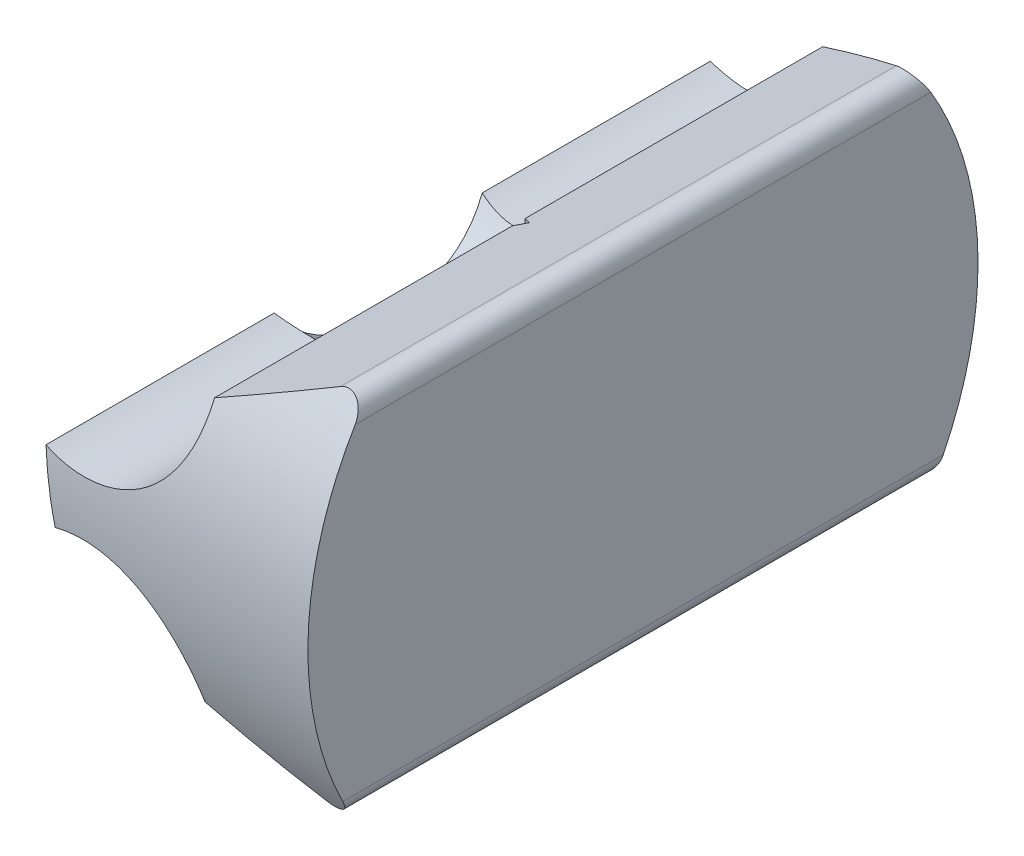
SolidWorks part; units mm, degrees
ref_plane "Front Plane" through (0, 0, 0) normal (0, 0, 1) x (1, 0, 0)
ref_plane "Top Plane" through (0, 0, 0) normal (0, 1, 0) x (1, 0, 0)
ref_plane "Right Plane" through (0, 0, 0) normal (1, 0, 0) x (0, 0, -1)
sketch "Sketch1" plane through (0, 0, 0) normal (0, 0, 1) x (1, 0, 0)
  line L0 (0, 0.6379) -> (0, 8.1632)
  line L1 (-0.5782, 8.5315) -> (-2.921, 7.439)
  line L2 (-6.223, 5.1625) -> (-5.9543, 3.6385)
  line L3 (-2.921, 1.3621) -> (-0.5782, 0.2696)
  line L4 (-6.1168, 8.0381) -> (-6.1168, -3.6188) construction
  line L5 (-14.1613, 4.4005) -> (14.1613, 4.4005) construction
  arc A0 (-2.921, 7.439) -> (-6.223, 5.1625) centre (-5.3075, 7.3677) cw
  arc A1 (-5.9543, 3.6385) -> (-2.921, 1.3621) centre (-5.3085, 1.3399) cw
  arc A2 (0, 0.6379) -> (-0.5782, 0.2696) centre (-0.4064, 0.6379) cw
  arc A3 (0, 8.1632) -> (-0.5782, 8.5315) centre (-0.4064, 8.1632) ccw
  point P13 (-6.0886, 4.4005)
  point P14 (0, 4.4005)
  point P17 (0, 0)
  point P20 (0, 8.8011)
  dimension "D1" = 2.3876
  dimension "D10" = 0.4064
  dimension "D2" = 8.8011
  dimension "D3" = 10
  dimension "D4" = 50
  dimension "D5" = 2.921
  dimension "D6" = 2.921
  dimension "D7" = 1.524
  dimension "D8" = 6.223
  dimension "D9" = 25
extrude "Boss-Extrude1" add sketch "Sketch1" along normal blind 15.9004
sketch "Sketch2" plane through (0, 0, 0) normal (1, 0, 0) x (0, 0, -1)
  line L0 (-7.9502, 8.8452) -> (-7.9502, 0) construction
  line L1 (0, 0.6379) -> (0, 8.1632) construction
  line L2 (0.0044, 4.131) -> (-15.9048, 4.131) construction
  line L3 (-15.9004, 8.5315) -> (0, 8.5315) construction
  line L4 (-2.743, -1.7754) -> (-13.5465, -1.4081)
  line L5 (-12.2587, 10.7216) -> (-3.7002, 10.7595)
  line L6 (-3.7002, 10.7595) -> (-3.724, 10.7188)
  arc A0 (-3.7002, 10.7595) -> (-2.743, -1.7754) centre (-7.9502, 4.131) cw
  arc A1 (-12.2587, 10.7216) -> (-13.5465, -1.4081) centre (-7.9502, 4.131) ccw
  point P8 (-7.9502, 4.131)
  dimension "D3" = 7.874
  dimension "D1" = 7.9502
  dimension "D2" = 4.4005
extrude "Cut-Extrude1" cut sketch "Sketch2" against normal blind 15.9004 flip side to cut contours A0 L4 A1 L5
sketch "Sketch3" plane through (0, 0, 0) normal (0, 0, 1) x (1, 0, 0)
  line L0 (-5.207, 0) -> (-5.207, 7.833) construction
  line L1 (0, 0.6379) -> (0, 8.1632) construction
  dimension "D1" = 5.207
ref_plane "Plane1" through (-5.207, 0, 0) normal (-1, 0, 0) x (0, 0, 1)
sketch "Sketch4" plane through (-5.207, 0, 0) normal (-1, 0, 0) x (0, 0, 1)
  line L0 (8.4582, 6.3754) -> (7.4422, 6.3754) construction
  line L1 (7.9502, 8.8452) -> (7.9502, 0) construction
  line L2 (15.7563, 5.1625) -> (0.1441, 5.1625) construction
  line L3 (15.8088, 3.6385) -> (0.0916, 3.6385) construction
  line L4 (8.9662, 4.1465) -> (6.9342, 4.1465)
  line L7 (10.3959, 5.1625) -> (5.5045, 5.1625)
  arc A0 (8.9662, 4.1465) -> (10.3959, 5.1625) centre (8.4582, 6.3754) ccw
  arc A1 (6.9342, 4.1465) -> (5.5045, 5.1625) centre (7.4422, 6.3754) cw
  point P6 (7.9502, 6.3754)
  dimension "D1" = 2.286
  dimension "D2" = 1.016
  dimension "D3" = 0.508
  dimension "D4" = 2.032
extrude "Cut-Extrude3" cut sketch "Sketch4" along normal through all from offset 0.254 contours L7 A1 L4 A0
sketch "Sketch7" plane through (-5.207, 0, 0) normal (-1, 0, 0) x (0, 0, 1)
  line L0 (8.9662, 4.1465) -> (8.9662, 3.6385)
  line L1 (15.8088, 3.6385) -> (0.0916, 3.6385) construction
  line L2 (8.9662, 3.6385) -> (6.9342, 3.6385)
  line L3 (6.9342, 3.6385) -> (6.9342, 4.1465)
  line L4 (8.9662, 4.1465) -> (6.9342, 4.1465)
extrude "Cut-Extrude4" cut sketch "Sketch7" along normal through all contours L4 L3 L2 L0
ref_plane "Plane2" through (-2.921, 0, 0) normal (-1, 0, 0) x (0, 0, 1)
ref_plane "Plane6" through (0, 0, 7.9502) normal (0, 0, 1) x (1, 0, 0)
sketch "Sketch13" plane through (0, 0, 0) normal (1, 0, 0) x (0, 0, -1)
  line L0 (-16.6569, 6.169) -> (0.9663, 6.169) construction
  line L1 (-15.0956, 7.439) -> (-0.8048, 7.439) construction
  dimension "D1" = 1.27
ref_plane "Plane7" through (0, 6.169, 0) normal (0, -1, 0) x (0, 0, -1)
sketch "Sketch14" plane through (0, 6.169, 0) normal (0, -1, 0) x (0, 0, -1)
  line L0 (-8.8301, -4.191) -> (-7.9502, -2.667)
  line L1 (-7.9502, -2.667) -> (-7.0703, -4.191)
  line L2 (-7.0703, -4.191) -> (-8.8301, -4.191)
  line L3 (0.0044, 0) -> (-15.9048, 0) construction
  line L4 (-7.9502, 3.5065) -> (-7.9502, -3.5065) construction
  line L5 (-15.0956, -2.921) -> (-0.8048, -2.921) construction
  point P5 (-7.9502, 0)
  dimension "D1" = 60
  dimension "D2" = 30
  dimension "D3" = 0.254
  dimension "D4" = 1.27
extrude "Cut-Extrude7" cut sketch "Sketch14" against normal blind 13.3604 contours L2 L0 L1
